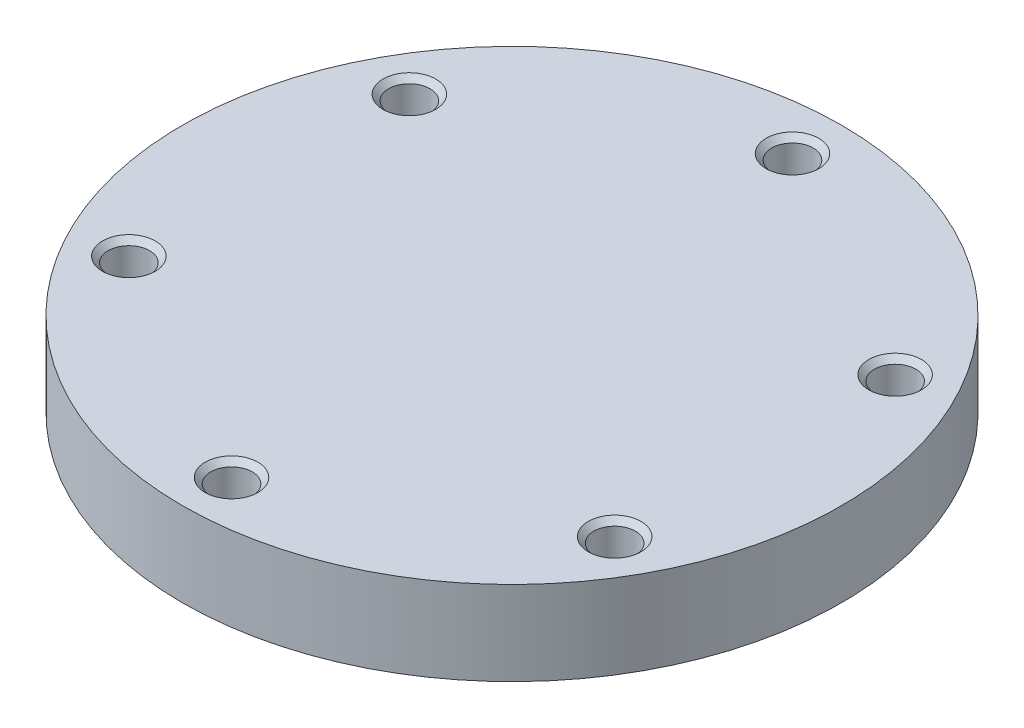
SolidWorks part; units mm, degrees
ref_plane "Front" through (0, 0, 0) normal (0, 0, 1) x (1, 0, 0)
ref_plane "Top" through (0, 0, 0) normal (0, 1, 0) x (1, 0, 0)
ref_plane "Right" through (0, 0, 0) normal (1, 0, 0) x (0, 0, -1)
sketch "Sketch1" plane through (0, 0, 0) normal (0, 1, 0) x (1, 0, 0)
  circle A0 centre (0, 0) radius 37.3062
  dimension "D1" = 74.6125
extrude "Boss-Extrude1" add sketch "Sketch1" along normal blind 9.525
hole_wizard "#13 (0.185) Diameter Hole1" positions "Sketch2" profile "Sketch3" hole size "#13" standard "ANSI Inch"
sketch "Sketch2" plane through (0, 9.525, 0) normal (0, 1, 0) x (1, 0, 0)
  point P0 (0, 31.75)
  point P9 (27.4963, 15.875)
  point P10 (27.4963, -15.875)
  point P11 (0, -31.75)
  point P12 (-27.4963, -15.875)
  point P13 (-27.4963, 15.875)
  dimension "D1" = 31.75
  dimension "D2" = 6
sketch "Sketch3" plane through (0, 9.525, -31.75) normal (1, 0, 0) x (0, 0, 1)
  line L0 (0, 0) -> (0, 9.525)
  line L1 (0, 9.525) -> (2.9845, 9.525)
  line L2 (2.3495, 8.89) -> (2.3495, 0.635)
  line L3 (2.3495, 0.635) -> (2.9845, 0)
  line L5 (2.9845, 0) -> (0, 0)
  line L6 (-2.3495, 0.635) -> (-2.9845, 0) construction
  line L7 (2.9845, 9.525) -> (2.3495, 8.89)
  line L8 (-2.9845, 9.525) -> (-2.3495, 8.89) construction
  line L11 (0, -6.35) -> (0, 107.95) construction
  dimension "Thru Hole Dia." = 4.699
  dimension "Thru Hole Depth" = 9.525
  dimension "Near C'Sink Dia." = 5.969
  dimension "Near C'Sink Angle" = 90
  dimension "Far C'Sink Dia." = 5.969
  dimension "Far C'Sink Angle" = 90
sketch "Sketch4" plane through (0, 0, 0) normal (0, -1, 0) x (1, 0, 0)
  circle A0 centre (0, 0) radius 27.6987
  circle A1 centre (0, 0) radius 23.6093
  dimension "D1" = 47.2186
  dimension "D2" = 4.0894
extrude "Cut-Extrude1" cut sketch "Sketch4" against normal blind 2.6416
